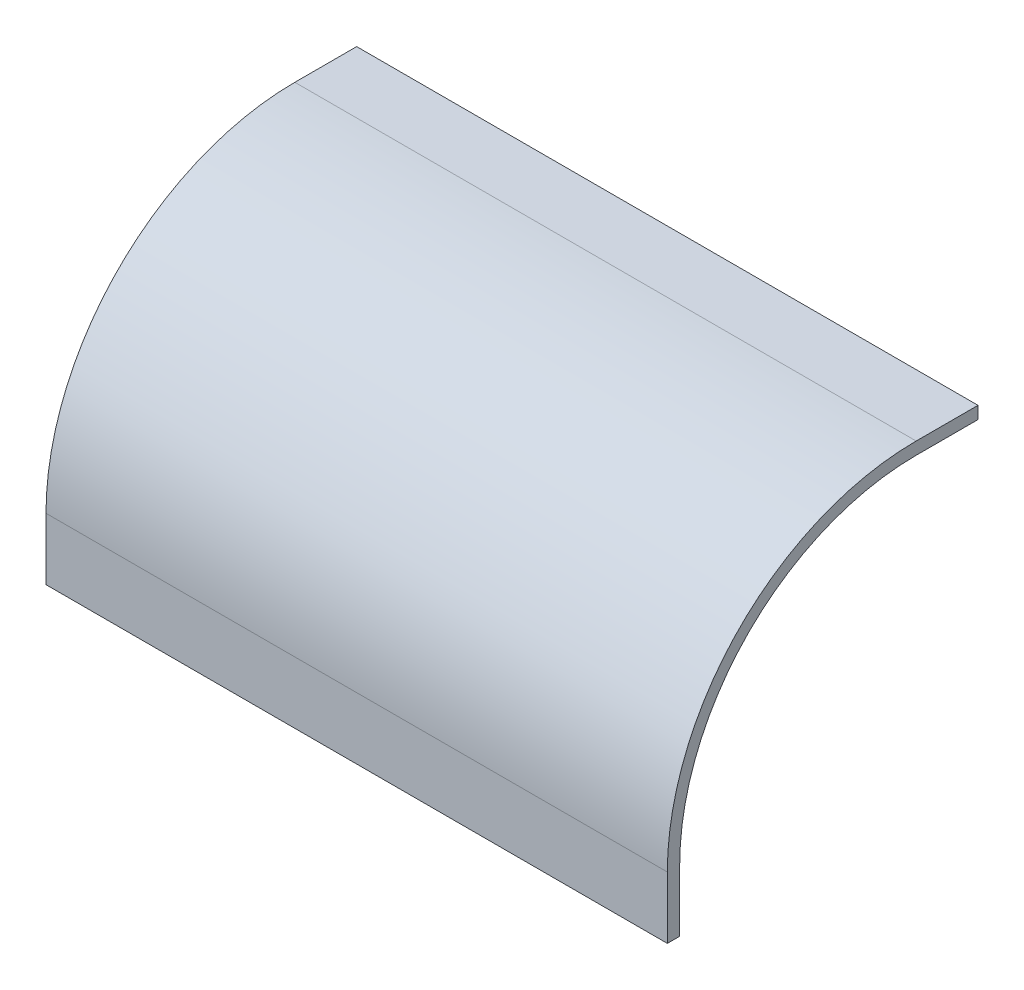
SolidWorks part; units mm, degrees
ref_plane "Front Plane" through (0, 0, 0) normal (0, 0, 1) x (1, 0, 0)
ref_plane "Top Plane" through (0, 0, 0) normal (0, 1, 0) x (1, 0, 0)
ref_plane "Right Plane" through (0, 0, 0) normal (1, 0, 0) x (0, 0, -1)
sketch "Sketch1" plane through (0, 0, 0) normal (1, 0, 0) x (0, 0, -1)
  line L0 (0, 0) -> (0, 50)
  line L1 (200, 250) -> (250, 250)
  line L2 (250, 250) -> (250, 200) construction
  line L3 (250, 200) -> (200, 200) construction
  line L4 (50, 50) -> (50, 0) construction
  line L5 (50, 0) -> (0, 0) construction
  arc A0 (0, 50) -> (200, 250) centre (200, 50) cw
  arc A1 (200, 200) -> (50, 50) centre (200, 50) ccw construction
  dimension "D3" = 150
  dimension "D1" = 50
  dimension "D2" = 50
sketch "Sketch2" plane through (0, 0, 0) normal (0, 1, 0) x (1, 0, 0)
  line L0 (0, 0) -> (-500, 0)
  line L1 (-500, 8.786) -> (-501.214, 8.786)
  line L2 (-500, 0) -> (-500, 8.786)
  line L3 (0, 0) -> (0, 8.786)
  line L4 (0, 0) -> (0, 200) construction
  line L5 (1.214, -1.214) -> (1.214, 8.786)
  line L6 (1.214, -1.214) -> (-501.214, -1.214)
  line L7 (-501.214, -1.214) -> (-501.214, 8.786)
  line L8 (1.214, -1.214) -> (1.214, 10.3045) construction
  line L12 (0, 8.786) -> (1.214, 8.786)
  line L13 (-501.214, -1.214) -> (-501.214, 10.3045) construction
  arc A4 (1.214, 10.3045) -> (-0.1992, 15.1363) centre (0, 12.572) cw construction
  arc A5 (-501.214, 10.3045) -> (-499.8008, 15.1363) centre (-500, 12.572) ccw construction
  arc A6 (-500, 8.786) -> (-499.7068, 16.3466) centre (-500, 12.572) ccw construction
  arc A7 (0, 8.786) -> (-0.2932, 16.3466) centre (0, 12.572) cw construction
  dimension "D1" = 10
  dimension "D3" = 500
  dimension "D4" = 1.214
sweep "Sweep1" add profiles "Sketch2" path "Sketch1"
